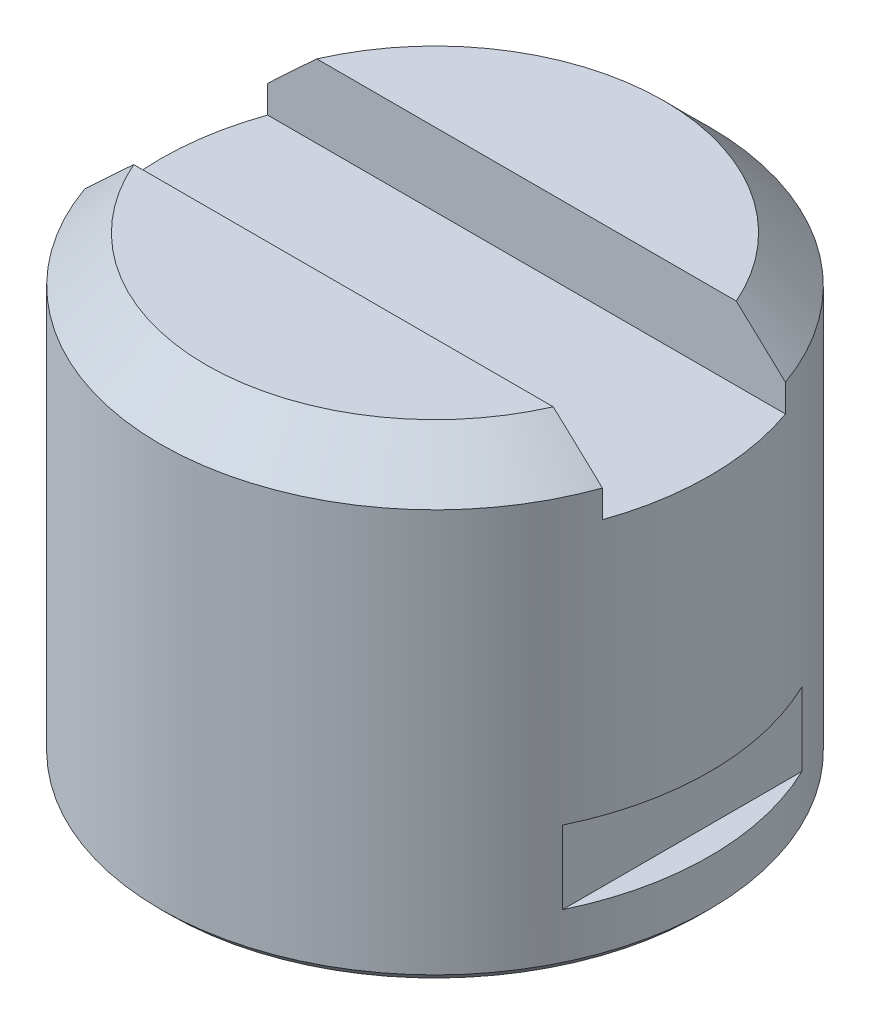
SolidWorks part; units mm, degrees
ref_plane "Front" through (0, 0, 0) normal (0, 0, 1) x (1, 0, 0)
ref_plane "Top" through (0, 0, 0) normal (0, 1, 0) x (1, 0, 0)
ref_plane "Right" through (0, 0, 0) normal (1, 0, 0) x (0, 0, -1)
sketch "Sketch1" plane through (0, 0, 0) normal (0, 1, 0) x (1, 0, 0)
  circle A0 centre (0, 0) radius 30
  dimension "D1" = 60
extrude "Boss-Extrude1" add sketch "Sketch1" along normal blind 50
sketch "Sketch2" plane through (0, 0, 0) normal (0, 0, 1) x (1, 0, 0)
  line L0 (-30, 50) -> (-30, 0) construction
  line L1 (-30, 14) -> (-27, 14)
  line L2 (-30, 14) -> (-30, 6)
  line L3 (-30, 6) -> (-27, 6)
  line L4 (-27, 14) -> (-27, 6)
  line L5 (-30, 0) -> (30, 0) construction
  line L6 (0, 0) -> (0, 13.1739) construction
  line L7 (27, 14) -> (27, 6)
  line L8 (30, 6) -> (27, 6)
  line L9 (30, 14) -> (30, 6)
  line L10 (30, 14) -> (27, 14)
  dimension "D1" = 6
  dimension "D2" = 8
  dimension "D3" = 3
extrude "Cut-Extrude1" cut sketch "Sketch2" against normal through all both and the other way through all
chamfer "Chamfer1" distance 5 angle 45 1 edges at (0, 50, 30)
chamfer "Chamfer2" distance 1 angle 45 1 edges at (0, 0, 30)
sketch "Sketch3" plane through (0, 0, 0) normal (1, 0, 0) x (0, 0, -1)
  line L0 (25, 50) -> (-25, 50) construction
  line L1 (-10, 50) -> (10, 50)
  line L2 (-10, 50) -> (-10, 42)
  line L3 (-10, 42) -> (10, 42)
  line L4 (10, 50) -> (10, 42)
  line L5 (0, 0) -> (0, 42) construction
  dimension "D1" = 8
  dimension "D2" = 20
extrude "Cut-Extrude2" cut sketch "Sketch3" against normal through all both and the other way through all
